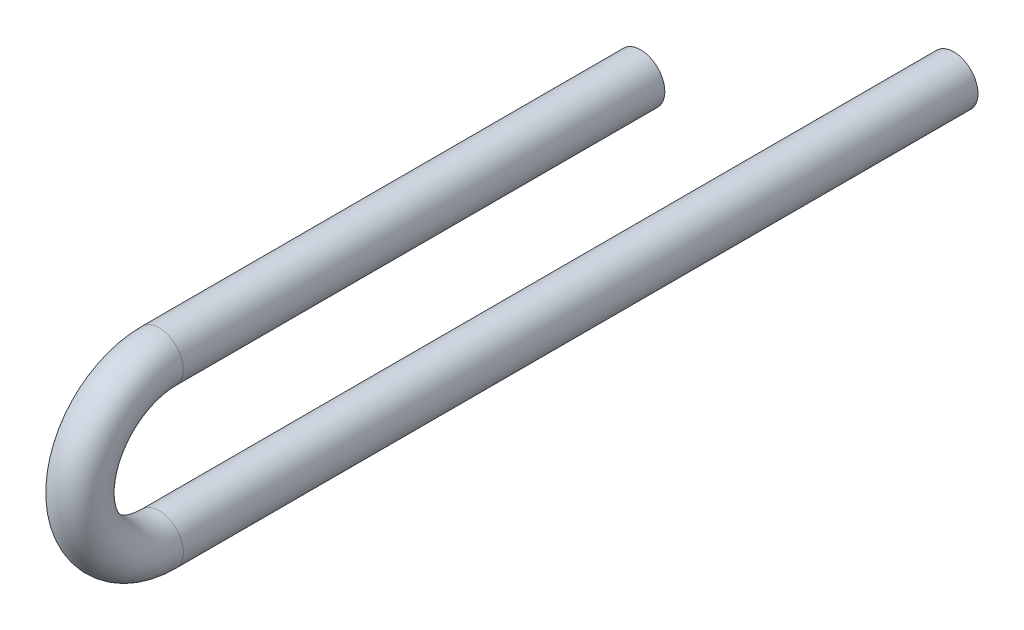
SolidWorks part; units mm, degrees
ref_plane "Plane1" through (0, 0, 0) normal (0, 0, 1) x (1, 0, 0)
ref_plane "Plane2" through (0, 0, 0) normal (0, 1, 0) x (1, 0, 0)
ref_plane "Plane3" through (0, 0, 0) normal (1, 0, 0) x (0, 0, -1)
sketch "Sketch1" plane through (0, 0, 0) normal (0, 0, 1) x (1, 0, 0)
  circle A0 centre (0, 0) radius 0.762
  dimension "D1" = 1.524
extrude "Base-Extrude" add sketch "Sketch1" along normal blind 12.7
sketch "Sketch2" plane through (0, 0, 12.7) normal (0, 0, 1) x (1, 0, 0)
  circle A0 centre (0, 0) radius 0.762
sketch "Sketch3" plane through (0, 0, 0) normal (1, 0, 0) x (0, 0, -1)
  line L0 (-12.7, 0) -> (-15.1871, 0)
  line L1 (-12.7, 0) -> (0, 0) construction
  line L3 (-15.1871, -4.995) -> (9.8782, -4.995)
  arc A0 (-15.1871, 0) -> (-15.1871, -4.995) centre (-15.1871, -2.4975) ccw
  point P8 (-17.7271, 0)
sweep "Boss-Sweep1" add profiles "Sketch2" path "Sketch3"
